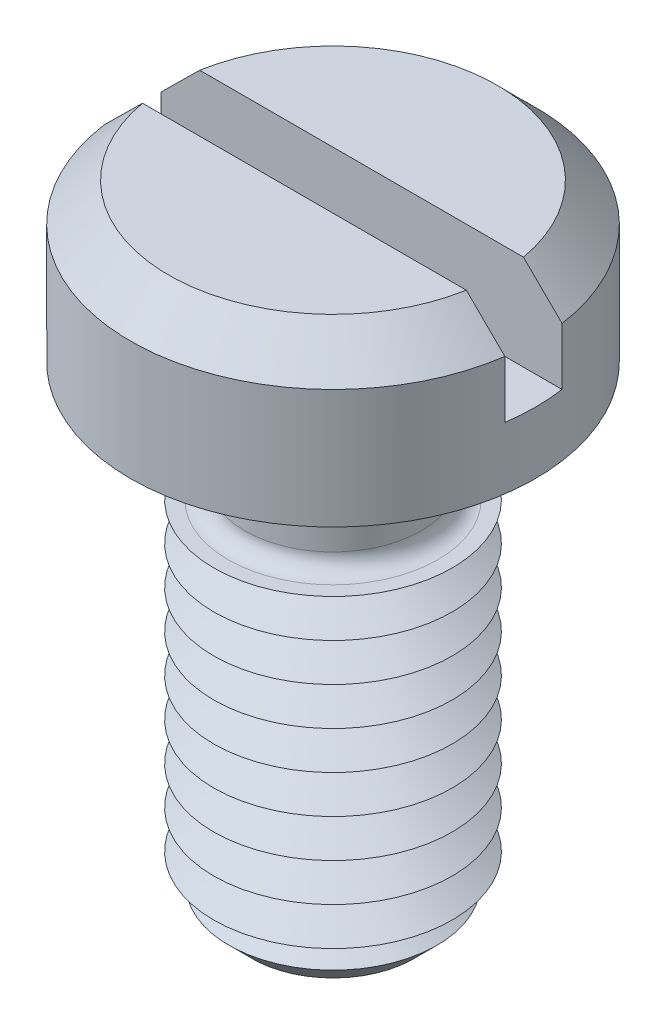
SolidWorks part; units mm, degrees
ref_plane "Front Plane" through (0, 0, 0) normal (0, 0, 1) x (1, 0, 0)
ref_plane "Top Plane" through (0, 0, 0) normal (0, 1, 0) x (1, 0, 0)
ref_plane "Right Plane" through (0, 0, 0) normal (1, 0, 0) x (0, 0, -1)
sketch "Sketch1" plane through (0, 0, 0) normal (0, 1, 0) x (1, 0, 0)
  circle A0 centre (0, 0) radius 4.25
  dimension "D1" = 8.5
extrude "Boss-Extrude1" add sketch "Sketch1" along normal blind 3.3
sketch "Sketch2" plane through (0, 0, 0) normal (0, -1, 0) x (1, 0, 0)
  circle A0 centre (0, 0) radius 1.85
  dimension "D1" = 3.7
extrude "Boss-Extrude2" add sketch "Sketch2" along normal blind 10
sketch "Sketch3" plane through (0, -10, 0) normal (0, -1, 0) x (1, 0, 0)
  circle A0 centre (0, 0) radius 2.5
  dimension "D1" = 5
extrude "Boss-Extrude3" add sketch "Sketch3" against normal blind 7.5
chamfer "Chamfer1" distance 0.8 angle 45 1 edges at (0, -10, -2.5)
sketch "Sketch4" plane through (0, 0, 0) normal (1, 0, 0) x (0, 0, -1)
  line L0 (0, -6.5871) -> (0, -12.0372) construction
sketch "Sketch5" plane through (0, 0, 0) normal (1, 0, 0) x (0, 0, -1)
  line L0 (-2.5, -2.5) -> (-1.8072, -2.9)
  line L1 (-1.8072, -2.9) -> (-2.5, -3.3)
  line L2 (-2.5, -2.5) -> (-2.5, -9.2) construction
  line L3 (-2.5, -3.3) -> (-2.5, -2.5)
  dimension "D1" = 0.8
revolve "Cut-Revolve1" cut sketch "Sketch5" angle 360 about L0
pattern_linear "LPattern1" count 9 spacing 0.8 along (0, -1, 0) of "Cut-Revolve1"
fillet "Fillet1" radius 0.35 2 edges at (0, -2.5, -1.85) (0, 0, -1.85)
chamfer "Chamfer2" distance 0.8 angle 45 1 edges at (0, 3.3, 4.25)
sketch "Sketch6" plane through (0, 3.3, 0) normal (0, 1, 0) x (1, 0, 0)
  line L1 (4.25, -0.6) -> (-4.25, -0.6)
  line L2 (4.25, -0.6) -> (4.25, 0.6)
  line L3 (4.25, 0.6) -> (-4.25, 0.6)
  line L4 (-4.25, -0.6) -> (-4.25, 0.6)
  line L5 (4.25, -0.6) -> (-4.25, 0.6) construction
  line L6 (4.25, 0.6) -> (-4.25, -0.6) construction
  circle A0 centre (0, 0) radius 4.25 construction
  point P0 (0, 0)
  dimension "D1" = 1.2
extrude "Cut-Extrude1" cut sketch "Sketch6" against normal blind 2
